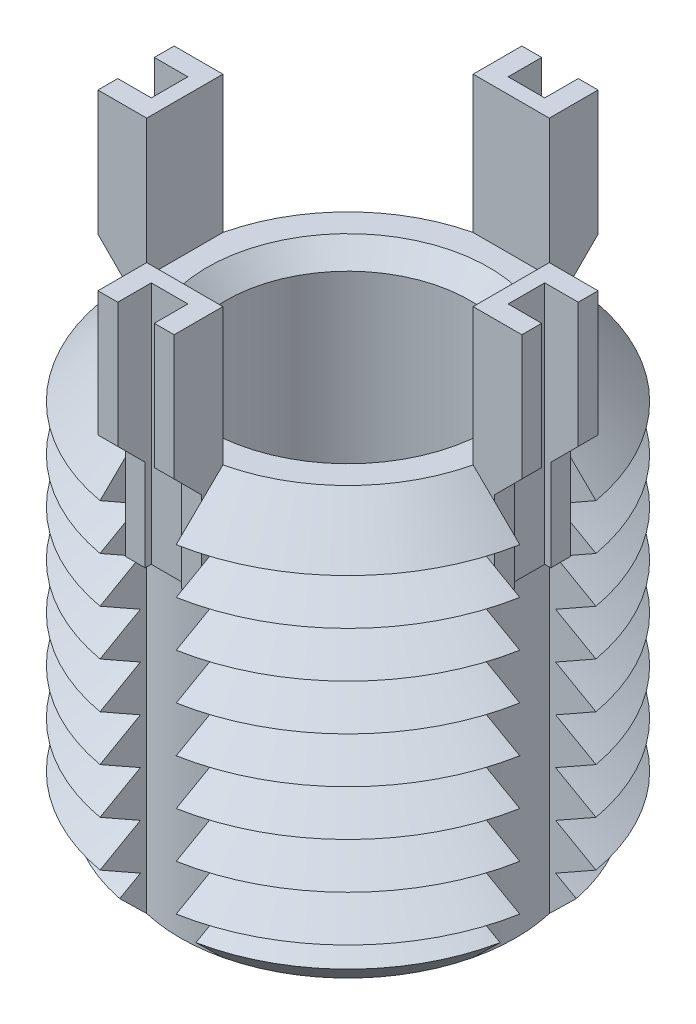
SolidWorks part; units mm, degrees
ref_plane "Front Plane" through (0, 0, 0) normal (0, 0, 1) x (1, 0, 0)
ref_plane "Top Plane" through (0, 0, 0) normal (0, 1, 0) x (1, 0, 0)
ref_plane "Right Plane" through (0, 0, 0) normal (1, 0, 0) x (0, 0, -1)
sketch "Sketch1" plane through (0, 0, 0) normal (0, 1, 0) x (1, 0, 0)
  circle A0 centre (0, 0) radius 7
  dimension "D1" = 14
extrude "Boss-Extrude1" add sketch "Sketch1" against normal blind 14
chamfer "Chamfer1" distance 1.5 angle 45 2 edges at (0, -14, 7) (0, 0, 7)
sketch "Sketch2" plane through (0, 0, 0) normal (1, 0, 0) x (0, 0, -1)
  line L0 (0, 0.8859) -> (0, -9.2617) construction
sketch "Sketch3" plane through (0, 0, 0) normal (1, 0, 0) x (0, 0, -1)
  line L0 (-7, -1.5) -> (-5.701, -2.25)
  line L1 (-5.701, -2.25) -> (-7, -3)
  line L2 (-7, -1.5) -> (-7, -12.5) construction
  line L3 (-7, -3) -> (-7, -1.5)
  dimension "D1" = 1.5
revolve "Cut-Revolve1" cut sketch "Sketch3" angle 360 about L0
pattern_linear "LPattern1" count 8 spacing 1.5 along (0, -1, 0) of "Cut-Revolve1"
sketch "Sketch4" plane through (0, 0, 0) normal (0, 1, 0) x (1, 0, 0)
  line L0 (-5.3561, 1.25) -> (-6.8875, 1.25)
  line L2 (-6.8875, -1.25) -> (-5.3561, -1.25)
  arc A0 (-5.3561, 1.25) -> (-5.3561, -1.25) centre (0, 0) ccw
  arc A1 (-6.8875, 1.25) -> (-6.8875, -1.25) centre (0, 0) ccw
  circle A2 centre (0, 0) radius 7 construction
  circle A3 centre (0, 0) radius 5.5 construction
  point P1 (-5.5, 0)
  point P3 (-7, 0)
  point P13 (0, 0)
  dimension "D1" = 2.5
extrude "Cut-Extrude1" cut sketch "Sketch4" against normal up to surface (14 mm away)
pattern_circular "CirPattern1" count 4 over 360 about axis through (0, 0, 0) along (0, 1, 0) of "Cut-Extrude1"
sketch "Sketch5" plane through (0, 0, 0) normal (1, 0, 0) x (0, 0, -1)
  line L0 (-5.3561, 4.5) -> (-5.3561, -3.5)
  line L1 (-5.3561, -3.5) -> (-6.0561, -3.5)
  line L2 (-6.0561, -3.5) -> (-6.0561, -0.5)
  line L3 (-6.0561, -0.5) -> (-6.9561, 0.4)
  line L4 (-6.9561, 0.4) -> (-6.9561, 4.5)
  line L5 (-6.9561, 4.5) -> (-5.3561, 4.5)
  line L6 (-6.8875, -4.5) -> (-1.25, -4.5) construction
  point P9 (-1.25, 0)
  point P10 (-6.0561, -0.5)
  dimension "D1" = 1
  dimension "D2" = 8
  dimension "D3" = 5
  dimension "D4" = 1.6
  dimension "D5" = 0.7
  dimension "D6" = 45
extrude "Boss-Extrude3" add sketch "Sketch5" along normal mid plane 2.5
pattern_circular "CirPattern2" count 4 over 360 about axis through (0, 0, 0) along (0, 1, 0) of "Boss-Extrude3"
sketch "Sketch6" plane through (0, 4.5, 0) normal (0, 1, 0) x (1, 0, 0)
  line L0 (-6.9561, -1.25) -> (-6.9561, 1.25) construction
  line L1 (-6.9561, -0.6) -> (-5.8561, -0.6)
  line L2 (-6.9561, -0.6) -> (-6.9561, 0.6)
  line L3 (-6.9561, 0.6) -> (-5.8561, 0.6)
  line L4 (-5.8561, -0.6) -> (-5.8561, 0.6)
  line L5 (-6.9561, -0.6) -> (-5.8561, 0.6) construction
  line L6 (-6.9561, 0.6) -> (-5.8561, -0.6) construction
  line L7 (6.9561, 1.25) -> (6.9561, -1.25) construction
  line L8 (-0.6, 5.8561) -> (0.6, 5.8561)
  line L9 (-0.6, 5.8561) -> (-0.6, 6.9561)
  line L10 (-0.6, 6.9561) -> (0.6, 6.9561)
  line L11 (0.6, 5.8561) -> (0.6, 6.9561)
  line L12 (-0.6, 5.8561) -> (0.6, 6.9561) construction
  line L13 (-0.6, 6.9561) -> (0.6, 5.8561) construction
  line L14 (5.8561, -0.6) -> (6.9561, -0.6)
  line L15 (5.8561, -0.6) -> (5.8561, 0.6)
  line L16 (5.8561, 0.6) -> (6.9561, 0.6)
  line L17 (6.9561, -0.6) -> (6.9561, 0.6)
  line L18 (5.8561, -0.6) -> (6.9561, 0.6) construction
  line L19 (5.8561, 0.6) -> (6.9561, -0.6) construction
  line L20 (-0.6, -6.9561) -> (0.6, -6.9561)
  line L21 (-0.6, -6.9561) -> (-0.6, -5.8561)
  line L22 (-0.6, -5.8561) -> (0.6, -5.8561)
  line L23 (0.6, -6.9561) -> (0.6, -5.8561)
  line L24 (-0.6, -6.9561) -> (0.6, -5.8561) construction
  line L25 (-0.6, -5.8561) -> (0.6, -6.9561) construction
  line L26 (-1.25, 6.9561) -> (1.25, 6.9561) construction
  line L27 (1.25, -6.9561) -> (-1.25, -6.9561) construction
  point P0 (-6.4061, 0)
  point P7 (-6.9561, 0)
  point P8 (-6.9561, 0)
  point P9 (0, 6.4061)
  point P14 (6.4061, 0)
  point P19 (0, -6.4061)
  point P24 (0, 6.9561)
  point P25 (6.9561, 0)
  point P26 (6.9561, 0)
  point P27 (0, 6.9561)
  point P30 (0, -6.9561)
  point P33 (0, -6.9561)
  dimension "D1" = 1.2
  dimension "D2" = 1.1
extrude "Cut-Extrude3" cut sketch "Sketch6" against normal through all both and the other way through all
sketch "Sketch7" plane through (0, 0, 0) normal (0, 1, 0) x (1, 0, 0)
  circle A0 centre (0, 0) radius 4
  dimension "D1" = 8
extrude "Cut-Extrude4" cut sketch "Sketch7" against normal up to surface (14 mm away)
chamfer "Chamfer2" distance 0.625 angle 45 2 edges at (0, 0, 4) (0, -14, 4)
